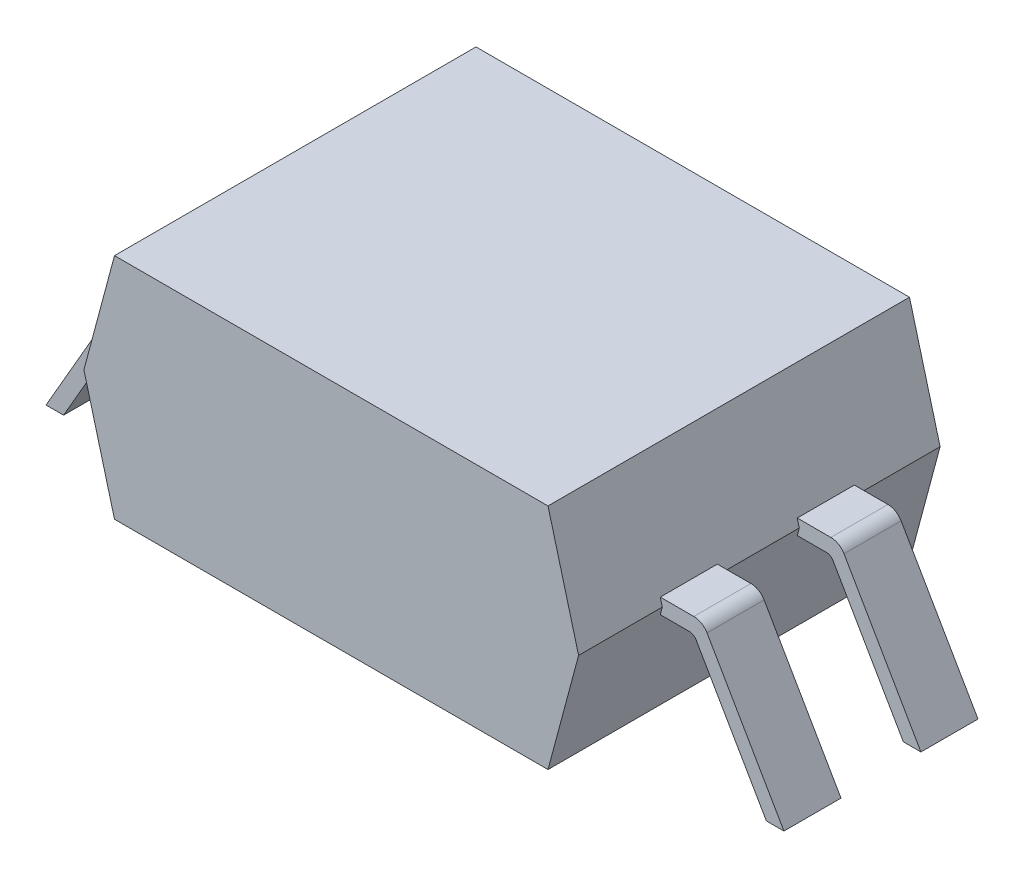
SolidWorks part; units mm, degrees
ref_plane "Front Plane" through (0, 0, 0) normal (0, 0, 1) x (1, 0, 0)
ref_plane "Top Plane" through (0, 0, 0) normal (0, 1, 0) x (1, 0, 0)
ref_plane "Right Plane" through (0, 0, 0) normal (1, 0, 0) x (0, 0, -1)
body saved out of another part "Stock-PSU-1"
